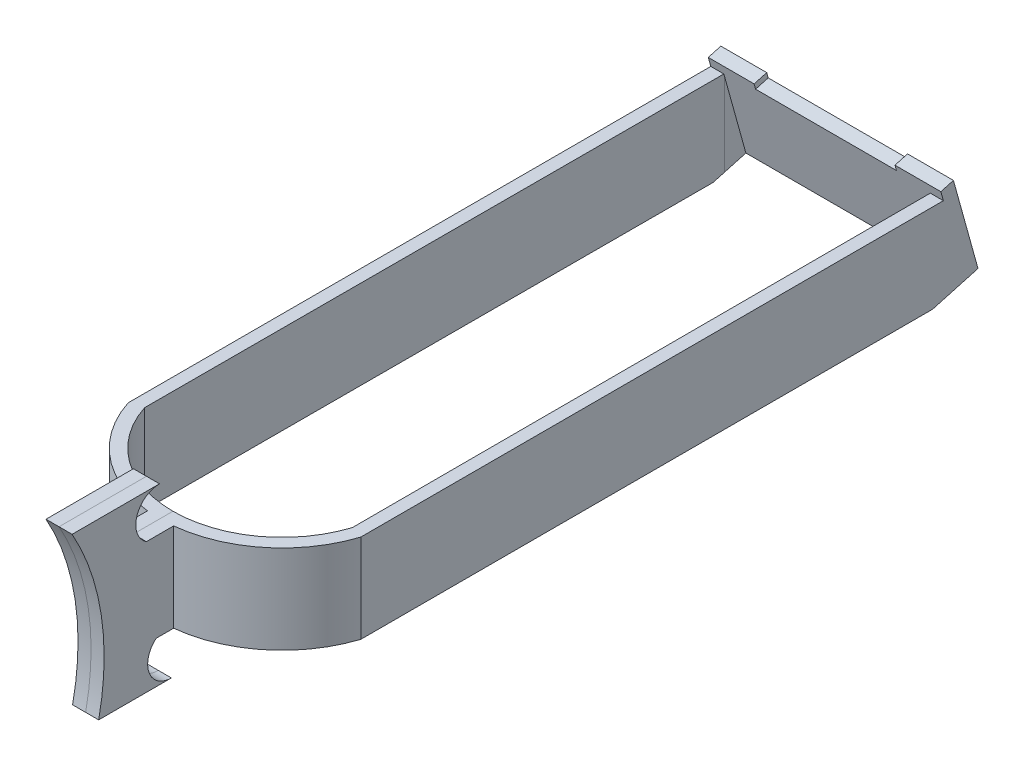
SolidWorks part; units mm, degrees
ref_plane "Front Plane" through (0, 0, 0) normal (0, 0, 1) x (1, 0, 0)
ref_plane "Top Plane" through (0, 0, 0) normal (0, 1, 0) x (1, 0, 0)
ref_plane "Right Plane" through (0, 0, 0) normal (1, 0, 0) x (0, 0, -1)
sketch "Sketch1" plane through (0, 0, 0) normal (1, 0, 0) x (0, 0, -1)
  line L0 (0, 0) -> (-53.2506, 0) construction
  line L1 (-34.535, 5.0546) -> (10.8813, 5.0546)
  line L2 (-33.6926, 7.8486) -> (-25.1881, 7.8486) construction
  line L3 (-32.9306, -3.3274) -> (-22.0432, -3.3274) construction
  line L4 (-33.9091, -0.635) -> (12.4592, -0.635)
  line L5 (-34.535, -0.635) -> (12.4592, -0.635) construction
  line L6 (-39.3056, 7.8486) -> (-33.6926, 7.8486)
  line L7 (-37.5984, -3.3274) -> (-32.9306, -3.3274)
  line L9 (12.4592, -0.635) -> (10.8813, 5.0546)
  line L10 (-34.535, 5.0546) -> (12.4592, 5.0546) construction
  arc A0 (-37.5984, -3.3274) -> (-39.3056, 7.8486) centre (-53.2506, 0) ccw
  arc A1 (-33.6926, 7.8486) -> (-34.535, 5.0546) centre (-33.6926, 6.3246) ccw
  arc A2 (-33.9091, -0.635) -> (-32.9306, -3.3274) centre (-32.9306, -1.8034) ccw
  dimension "D1" = 16.002
  dimension "D5" = 3.048
  dimension "D2" = 5.0546
  dimension "D3" = 19.558
  dimension "D4" = 20.32
  dimension "D6" = 2.794
  dimension "D7" = 11.176
  dimension "D9" = 65.7098
  dimension "D10" = 74.5
  dimension "D11" = 0
  dimension "D12" = 12.4592
  dimension "D13" = 65.7098
  dimension "D8" = 5.6896
extrude "Boss-Extrude1" add sketch "Sketch1" along normal mid plane 14.9352
sketch "Sketch2" plane through (0, 5.0546, 0) normal (0, 1, 0) x (1, 0, 0)
  line L0 (-6.6294, 10.0431) -> (-6.6701, -27.1411)
  line L1 (-0.8382, -33.6968) -> (0, -33.6968)
  line L2 (6.6701, -27.1411) -> (6.6294, 10.0431)
  line L3 (6.6294, 10.0431) -> (-6.6294, 10.0431)
  line L4 (0.8382, -39.3056) -> (-0.8382, -39.3056)
  line L5 (7.4676, -39.3056) -> (-7.4676, -39.3056) construction
  line L6 (-0.8382, -32.7872) -> (-0.8382, -39.3056)
  line L7 (-7.4676, -33.6926) -> (-7.4676, -39.3056) construction
  line L8 (-7.4676, 10.8813) -> (-7.4676, -34.535)
  line L9 (-7.4676, -34.535) -> (7.4676, -34.535)
  line L10 (7.4676, -34.535) -> (7.4676, 10.8813)
  line L11 (7.4676, 10.8813) -> (-7.4676, 10.8813)
  line L12 (-6.6294, -33.6968) -> (6.6294, -33.6968) construction
  line L13 (-0.8382, -34.535) -> (0.8382, -34.535)
  line L14 (-7.4676, 10.8813) -> (-7.4676, -34.535) construction
  line L15 (7.4676, 10.8813) -> (-7.4676, 10.8813)
  line L16 (-6.6294, 10.0431) -> (-6.6294, -33.6968) construction
  line L17 (-7.4676, 10.8813) -> (-7.4676, -34.535) construction
  line L18 (-7.4676, -34.535) -> (7.4676, -34.535) construction
  line L19 (6.6294, -33.6968) -> (6.6294, 10.0431) construction
  line L20 (7.4676, -34.535) -> (7.4676, 10.8813) construction
  line L21 (-7.4676, 10.8813) -> (-7.4676, -27.3991)
  line L22 (7.4676, 10.8813) -> (7.4676, -34.535) construction
  line L23 (7.4676, 10.8813) -> (7.4676, -27.3991)
  line L24 (-7.4676, -33.6926) -> (-7.4676, -39.3056)
  line L25 (-7.4676, 10.8813) -> (-7.4676, -34.535)
  line L26 (0, -33.4593) -> (0, -39.3056) construction
  line L27 (7.4676, 10.8813) -> (7.4676, -34.535)
  line L28 (0.8382, -32.7872) -> (0.8382, -39.3056)
  line L29 (7.4676, -39.3056) -> (-7.4676, -39.3056)
  arc A0 (-6.6701, -27.1411) -> (6.6701, -27.1411) centre (0, -24.9835) ccw
  arc A2 (-7.4676, -27.3991) -> (-0.8382, -32.7872) centre (0, -24.9835) ccw
  arc A3 (0.8382, -32.7872) -> (7.4676, -27.3991) centre (0, -24.9835) ccw
  arc A4 (-7.4676, -27.3991) -> (7.4676, -27.3991) centre (0, -24.9835) ccw construction
  dimension "D3" = 0
  dimension "D6" = 14.0208
  dimension "D4" = 0.8382
  dimension "D5" = 35.0266
  dimension "D7" = 0.8382
ref_plane "Plane1" through (0, 7.8486, 0) normal (0, 1, 0) x (-1, 0, 0)
sketch "Sketch4" plane through (0, 7.8486, 0) normal (0, 1, 0) x (-1, 0, 0)
  line L0 (7.4676, -10.8813) -> (7.4676, 27.3991) construction
  line L1 (6.6294, -10.0431) -> (6.6701, 27.1411) construction
  line L2 (-6.6294, -10.0431) -> (6.6294, -10.0431) construction
  line L3 (-7.4676, -10.8813) -> (7.4676, -10.8813) construction
  line L4 (-6.6701, 27.1411) -> (-6.6294, -10.0431) construction
  line L5 (-7.4676, -10.8813) -> (-7.4676, 27.3991) construction
  line L6 (-0.8382, 32.7872) -> (-0.8382, 39.3056) construction
  line L7 (0.8382, 32.7872) -> (0.8382, 39.3056) construction
  line L8 (-0.8382, 39.3056) -> (0.8382, 39.3056) construction
  line L9 (-7.4676, 39.3056) -> (7.4676, 39.3056) construction
  line L10 (7.4676, 33.6926) -> (7.4676, 39.3056) construction
  line L11 (-7.4676, 33.6926) -> (-7.4676, 39.3056) construction
  line L12 (-7.4676, -10.8813) -> (-7.4676, 34.535) construction
  line L13 (7.4676, -10.8813) -> (7.4676, 34.535) construction
  line L14 (7.4676, -10.8813) -> (7.4676, 27.3991)
  line L15 (6.6294, -10.0431) -> (6.6701, 27.1411)
  line L16 (-6.6294, -10.0431) -> (6.6294, -10.0431)
  line L17 (-7.4676, -10.8813) -> (7.4676, -10.8813)
  line L18 (-6.6701, 27.1411) -> (-6.6294, -10.0431)
  line L19 (-7.4676, -10.8813) -> (-7.4676, 27.3991)
  line L20 (-0.8382, 32.7872) -> (-0.8382, 39.3056)
  line L21 (0.8382, 32.7872) -> (0.8382, 39.3056)
  line L22 (-0.8382, 39.3056) -> (0.8382, 39.3056)
  line L23 (-7.4676, 39.3056) -> (7.4676, 39.3056)
  line L24 (7.4676, 33.6926) -> (7.4676, 39.3056)
  line L25 (-7.4676, 33.6926) -> (-7.4676, 39.3056)
  line L26 (-7.4676, -10.8813) -> (-7.4676, 34.535)
  line L27 (7.4676, -10.8813) -> (7.4676, 34.535)
  arc A0 (6.6701, 27.1411) -> (-6.6701, 27.1411) centre (0, 24.9835) ccw construction
  arc A1 (-0.8382, 32.7872) -> (-7.4676, 27.3991) centre (0, 24.9835) ccw construction
  arc A2 (7.4676, 27.3991) -> (0.8382, 32.7872) centre (0, 24.9835) ccw construction
  arc A3 (6.6701, 27.1411) -> (-6.6701, 27.1411) centre (0, 24.9835) ccw
  arc A4 (-0.8382, 32.7872) -> (-7.4676, 27.3991) centre (0, 24.9835) ccw
  arc A5 (7.4676, 27.3991) -> (0.8382, 32.7872) centre (0, 24.9835) ccw
extrude "Cut-Extrude1" cut sketch "Sketch4" against normal blind 14.9352 contours A4 L20 L23 L25 L26 | A5 L27 L24 L23 L21 | L15 A3 L18 L16
ref_plane "Plane2" through (0, 3.1631, -11.4059) normal (0, 0.2672, -0.9636) x (-1, 0, 0)
sketch "Sketch6" plane through (0, 3.1631, -11.4059) normal (0, 0.2672, -0.9636) x (-1, 0, 0)
  line L1 (-7.4676, 1.9629) -> (7.4676, 1.9629) construction
  line L3 (-4.5212, 1.6073) -> (4.5212, 1.6073)
  line L4 (-4.5212, 1.9629) -> (4.5212, 1.9629)
  line L5 (-4.5212, 1.6073) -> (-4.5212, 1.9629)
  line L6 (4.5212, 1.6073) -> (4.5212, 1.9629)
  point P8 (0, 1.6073)
  dimension "D1" = 0.3556
  dimension "D2" = 9.0424
  dimension "D3" = 0
extrude "Cut-Extrude2" cut sketch "Sketch6" along direction (0, 0, 1) on the side against the normal blind 14.9352
sketch "Sketch7" plane through (0, 7.8486, 0) normal (0, 1, 0) x (1, 0, 0)
  line L0 (0, -39.3056) -> (0, -28.7097)
  line L1 (0.8382, -39.3056) -> (-0.8382, -39.3056) construction
split "Split1" trim tools "Sketch7" bodies to split 103 resulting bodies 105
sketch "Sketch8" plane through (0, 3.1631, -11.4059) normal (0, 0.2672, -0.9636) x (-1, 0, 0)
  line L0 (-7.4676, -3.1033) -> (7.4676, -3.1033) construction
  line L1 (-7.4676, -3.1033) -> (7.4676, -3.1033)
  line L2 (-4.5212, 2.4455) -> (-4.5212, 2.8011)
  line L3 (7.4676, -3.1033) -> (7.4676, 2.8011)
  line L4 (7.4676, 2.8011) -> (4.5212, 2.8011)
  line L5 (-4.5212, 2.8011) -> (-7.4676, 2.8011)
  line L6 (4.5212, 2.4455) -> (-4.5212, 2.4455)
  line L7 (-7.4676, 2.8011) -> (-7.4676, -3.1033)
  line L8 (4.5212, 1.6073) -> (-4.5212, 1.6073)
  line L9 (-4.5212, 1.6073) -> (-4.5212, 1.9629)
  line L10 (-4.5212, 1.9629) -> (-7.4676, 1.9629)
  line L11 (-7.4676, 1.9629) -> (-7.4676, -3.9415)
  line L12 (-7.4676, -3.9415) -> (7.4676, -3.9415)
  line L13 (7.4676, -3.9415) -> (7.4676, 1.9629)
  line L14 (7.4676, 1.9629) -> (4.5212, 1.9629)
  line L15 (4.5212, 1.9629) -> (4.5212, 1.6073)
  line L19 (-7.4676, 1.9629) -> (-7.4676, -3.1033)
  line L21 (7.4676, -3.1033) -> (7.4676, 1.9629)
  line L24 (4.5212, 2.8011) -> (4.5212, 2.4455)
  line L27 (7.4676, -3.1033) -> (7.4676, 1.9629)
  line L31 (-7.4676, 1.9629) -> (-7.4676, -3.1033)
  dimension "D1" = 0
extrude "Boss-Extrude2" add sketch "Sketch8" against normal blind 0.8382 contours L4 L24 L6 L2 L5 L7 L3 M11 M10 M9 M16 M15 | L1 M12 M14 M15 M16 M9 M10 M11
sketch "Sketch9" plane through (0, 2.6992, 0.7485) normal (0, 0.9636, 0.2672) x (1, 0, 0)
  line L1 (-6.6294, 10.9982) -> (6.6294, 10.9982)
  line L6 (6.6294, 9.5082) -> (-6.6294, 9.5082) construction
  line L9 (-6.6294, 9.5082) -> (-6.6294, 10.9982)
  line L11 (6.6294, 9.5082) -> (-6.6294, 9.5082)
  line L13 (6.6294, 9.5082) -> (6.6294, 10.9982)
extrude "Cut-Extrude3" cut sketch "Sketch9" against normal through all
sketch "Sketch12" plane through (0, 3.1631, -11.4059) normal (0, 0.2672, -0.9636) x (-1, 0, 0)
  line L0 (-7.4676, -3.1033) -> (7.4676, -3.1033)
  line L1 (-7.4676, -3.9415) -> (7.4676, -3.9415) construction
  line L2 (7.4676, -3.9415) -> (7.4676, 2.8011) construction
  line L3 (-7.4676, -3.9415) -> (-7.4676, 2.8011) construction
  line L4 (-7.4676, -3.1033) -> (-7.4676, -3.9415)
  line L5 (-7.4676, -3.9415) -> (7.4676, -3.9415)
  line L6 (7.4676, -3.9415) -> (7.4676, -3.1033)
  point P4 (0, -3.1033)
  dimension "D1" = 0.8382
extrude "Cut-Extrude5" cut sketch "Sketch12" against normal through all
